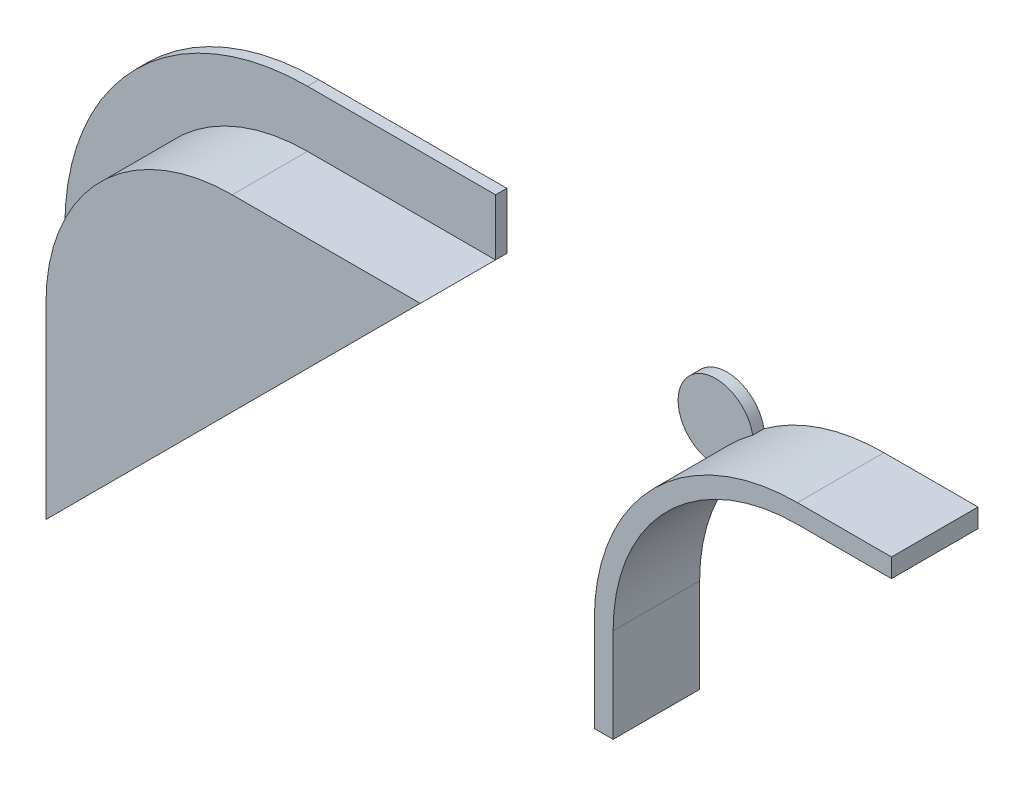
SolidWorks part; units mm, degrees
ref_plane "Ebene vorne" through (0, 0, 0) normal (0, 0, 1) x (1, 0, 0)
ref_plane "Ebene oben" through (0, 0, 0) normal (0, 1, 0) x (1, 0, 0)
ref_plane "Ebene rechts" through (0, 0, 0) normal (1, 0, 0) x (0, 0, -1)
sketch "Skizze1" plane through (0, 0, 0) normal (0, 0, 1) x (1, 0, 0)
  line L0 (0, 0) -> (0, 10.161) construction
  line L2 (-9.95, -9.95) -> (-9.95, 0.05)
  line L3 (-0.05, 9.95) -> (9.95, 9.95)
  line L5 (-9.95, -9.95) -> (9.95, 9.95)
  line L6 (-9.95, 9.95) -> (0, 0) construction
  arc A0 (-9.95, 0.05) -> (-0.05, 9.95) centre (-0.05, 0.05) cw
  point P0 (0, 0)
  dimension "D1" = 9.9
  dimension "D2" = 10
  dimension "D3" = 45
extrude "Aufsatz-Linear austragen1" add sketch "Skizze1" along normal blind 4
sketch "Skizze2" plane through (0, 0, 0) normal (0, 0, -1) x (-1, 0, 0)
  line L2 (-9.95, 12.95) -> (-9.95, 9.95)
  line L3 (-9.95, 9.95) -> (9.95, -9.95)
  line L4 (-9.95, 12.95) -> (0.05, 12.95)
  line L5 (12.95, 0.05) -> (12.95, -9.95)
  line L6 (-9.95, 12.95) -> (0.05, 12.95)
  line L7 (12.95, 0.05) -> (12.95, -9.95)
  line L8 (9.95, -9.95) -> (12.95, -9.95)
  arc A2 (12.95, 0.05) -> (0.05, 12.95) centre (0.05, 0.05) ccw
  arc A3 (12.95, 0.05) -> (0.05, 12.95) centre (0.05, 0.05) ccw
  dimension "D1" = 3
extrude "Aufsatz-Linear austragen2" add sketch "Skizze2" along normal blind 0.6
sketch "Skizze3" plane through (0, 0, 0) normal (0, 0, 1) x (1, 0, 0)
  line L4 (19.2, 0) -> (19.2, -5)
  line L5 (19.2, -5) -> (20.2, -5)
  line L6 (20.2, 0) -> (20.2, -5)
  line L7 (30, 9.8) -> (35, 9.8)
  line L9 (30, 10.8) -> (35, 10.8)
  line L10 (35, 9.8) -> (35, 10.8)
  arc A0 (30, 9.8) -> (20.2, 0) centre (30, 0) ccw
  arc A1 (30, 10.8) -> (19.2, 0) centre (30, 0) ccw
  circle A2 centre (30, 0) radius 9.8 construction
  circle A3 centre (30, 0) radius 10.8 construction
  dimension "D2" = 19.6
  dimension "D1" = 30
  dimension "D3" = 1
  dimension "D4" = 5
extrude "Aufsatz-Linear austragen3" add sketch "Skizze3" along normal blind 4 separate body
sketch "Skizze4" plane through (0, 0, 0) normal (0, 0, -1) x (-1, 0, 0)
  line L0 (-30, 0) -> (-19.2, 10.8) construction
  line L1 (-30, 10.8) -> (-19.2, 10.8) construction
  line L2 (-20.2, 0) -> (-20.2, -5)
  line L3 (-20.2, 0) -> (-20.2, -5)
  line L6 (-19.2, 0) -> (-19.2, 10.8) construction
  line L13 (-20.2, -5) -> (-19.2, -5)
  line L14 (-20.2, -5) -> (-19.2, -5)
  line L15 (-19.2, -5) -> (-19.2, 0)
  line L16 (-19.2, -5) -> (-19.2, 0)
  line L17 (-30, 10.8) -> (-35, 10.8)
  line L18 (-30, 10.8) -> (-35, 10.8)
  line L19 (-35, 10.8) -> (-35, 9.8)
  line L20 (-35, 10.8) -> (-35, 9.8)
  line L21 (-35, 9.8) -> (-30, 9.8)
  line L22 (-35, 9.8) -> (-30, 9.8)
  arc A0 (-21.2849, 6.3786) -> (-23.6214, 8.7151) centre (-21.6561, 8.3439) ccw
  arc A1 (-23.6214, 8.7151) -> (-30, 10.8) centre (-30, 0) ccw
  arc A2 (-20.2, 0) -> (-30, 9.8) centre (-30, 0) ccw
  arc A3 (-19.2, 0) -> (-30, 10.8) centre (-30, 0) ccw
  arc A4 (-20.2, 0) -> (-30, 9.8) centre (-30, 0) ccw
  arc A5 (-19.2, 0) -> (-21.2849, 6.3786) centre (-30, 0) ccw
  point P9 (-23.0704, 6.9296)
  dimension "D2" = 4
  dimension "D1" = 0
extrude "Aufsatz-Linear austragen4" add sketch "Skizze4" along normal blind 0.6
